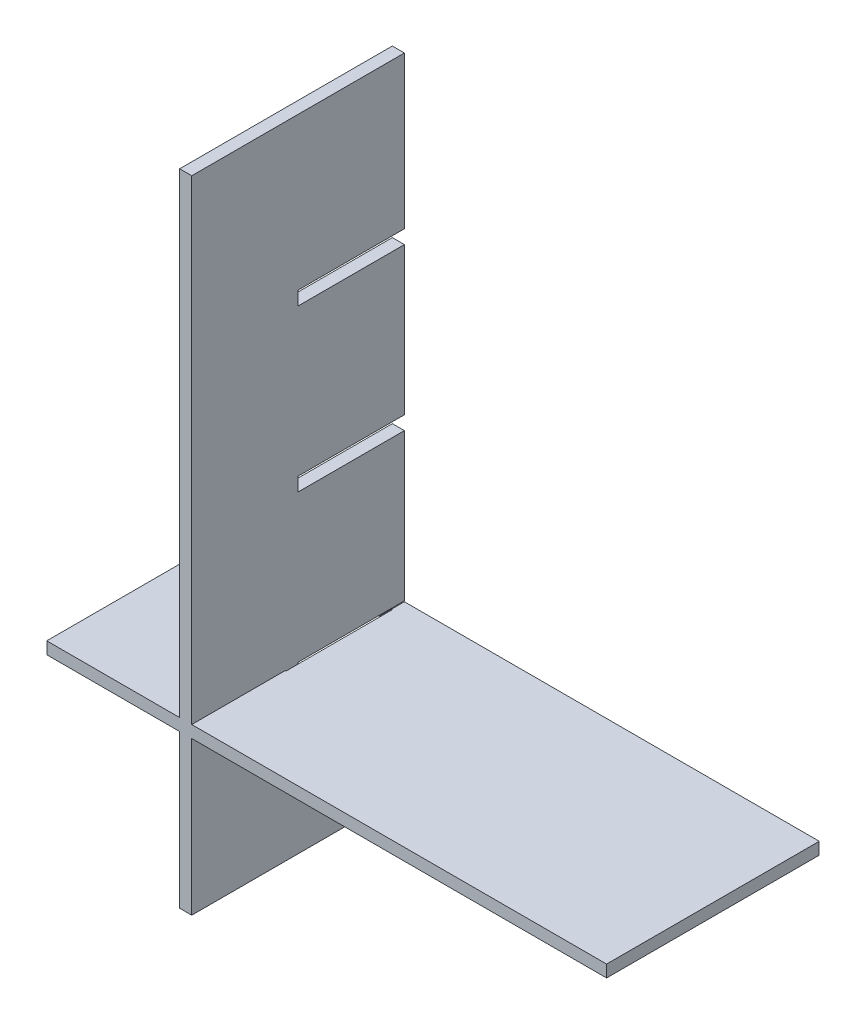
SolidWorks part; units mm, degrees
ref_plane "Alzado" through (0, 0, 0) normal (0, 0, 1) x (1, 0, 0)
ref_plane "Planta" through (0, 0, 0) normal (0, 1, 0) x (1, 0, 0)
ref_plane "Vista lateral" through (0, 0, 0) normal (1, 0, 0) x (0, 0, -1)
sketch "Croquis14" plane through (0, 0, 0) normal (0, 0, 1) x (1, 0, 0)
  line L0 (-34.75, -19.25) -> (-34.75, -20.75)
  line L1 (-35, -19) -> (35, -19) construction
  line L2 (-35, -19) -> (-35, -21) construction
  line L3 (-35, -21) -> (35, -21) construction
  line L4 (35, -19) -> (35, -21) construction
  line L5 (-34.75, -20.75) -> (34.75, -20.75)
  line L6 (34.75, -19.25) -> (34.75, -20.75)
  line L7 (-34.75, -19.25) -> (34.75, -19.25)
  dimension "D1" = 0.25
extrude "Saliente-Extruir8" add sketch "Croquis14" along normal blind 26.4
sketch "Croquis17" plane through (0, -20.75, 0) normal (0, -1, 0) x (1, 0, 0)
  line L0 (-18.35, 1.6) -> (-16.65, 1.6)
  line L3 (-18.35, 14.8) -> (-16.65, 14.8)
  line L9 (-18.35, 1.6) -> (-18.35, 14.8)
  line L11 (-16.65, 1.6) -> (-16.65, 14.8)
  dimension "D1" = 1.7
  dimension "D2" = 13.2
extrude "Cortar-Extruir1" cut sketch "Croquis17" against normal up to surface (1.5 mm away)
sketch "Croquis16" plane through (0, 0, 0) normal (0, 0, 1) x (1, 0, 0)
  line L0 (-18.25, -39.75) -> (-16.75, -39.75)
  line L1 (-18.5, -40) -> (-16.5, -40) construction
  line L2 (-18.5, -40) -> (-18.5, 40) construction
  line L3 (-18.5, 40) -> (-16.5, 40) construction
  line L4 (-16.5, -40) -> (-16.5, 40) construction
  line L5 (-16.75, -39.75) -> (-16.75, 39.75)
  line L6 (-18.25, 39.75) -> (-16.75, 39.75)
  line L7 (-18.25, -39.75) -> (-18.25, 39.75)
  dimension "D1" = 0.25
extrude "Saliente-Extruir9" add sketch "Croquis16" along normal blind 26.4
sketch "Croquis20" plane through (-16.75, 0, 0) normal (1, 0, 0) x (0, 0, -1)
  line L1 (0, -20.85) -> (-13.2, -20.85)
  line L2 (0, -20.85) -> (0, -19.15)
  line L3 (0, -19.15) -> (-13.2, -19.15)
  line L4 (-13.2, -20.85) -> (-13.2, -19.15)
  line L10 (0, -0.85) -> (-13.2, -0.85)
  line L11 (0, -0.85) -> (0, 0.85)
  line L12 (0, 0.85) -> (-13.2, 0.85)
  line L13 (-13.2, -0.85) -> (-13.2, 0.85)
  line L14 (0, 19.15) -> (-13.2, 19.15)
  line L15 (0, 19.15) -> (0, 20.85)
  line L16 (0, 20.85) -> (-13.2, 20.85)
  line L17 (-13.2, 19.15) -> (-13.2, 20.85)
  line L22 (0, -19.25) -> (0, 39.75) construction
  dimension "D1" = 1.7
  dimension "D2" = 13.2
  dimension "D4" = 1.7
  dimension "D5" = 1.7
  dimension "D6" = 13.2
  dimension "D7" = 13.2
extrude "Cortar-Extruir2" cut sketch "Croquis20" against normal up to surface (1.5 mm away)
